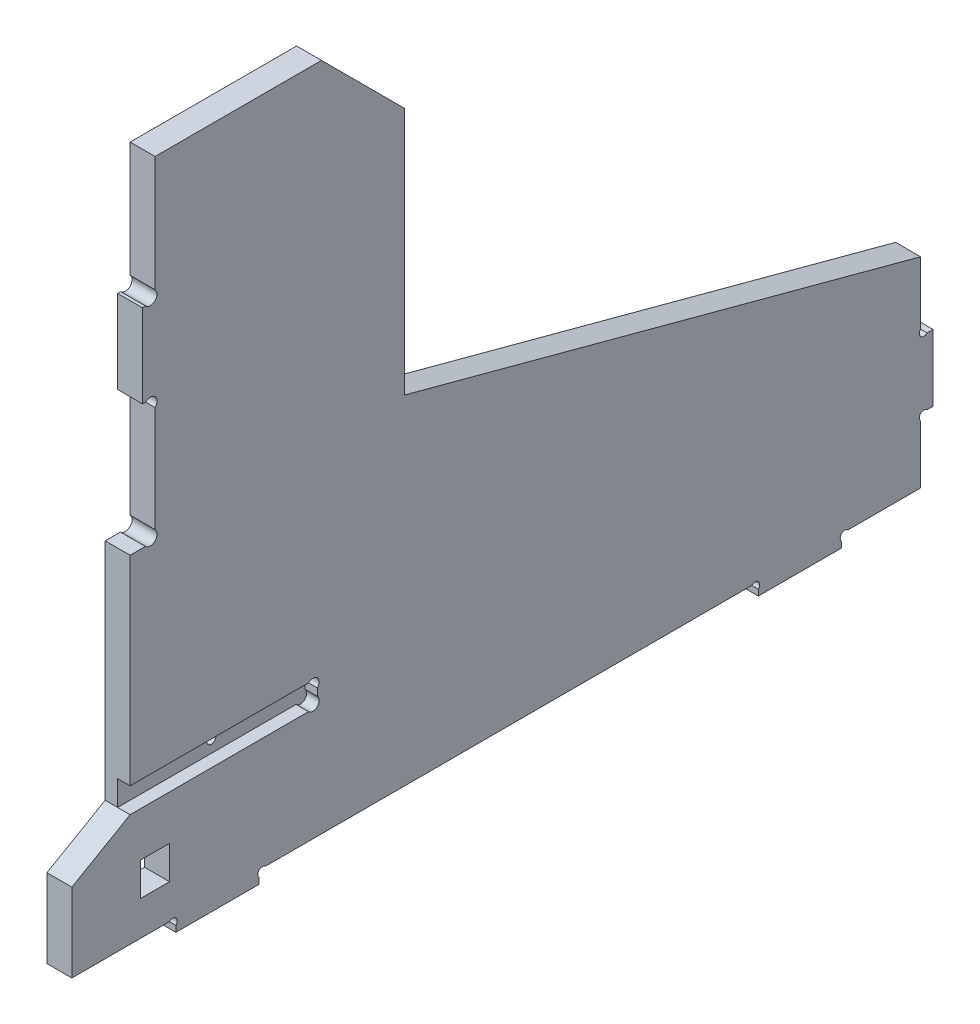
SolidWorks part; units mm, degrees
ref_plane "Plan de face" through (0, 0, 0) normal (0, 0, 1) x (1, 0, 0)
ref_plane "Plan de dessus" through (0, 0, 0) normal (0, 1, 0) x (1, 0, 0)
ref_plane "Plan de droite" through (0, 0, 0) normal (1, 0, 0) x (0, 0, -1)
sketch "Esquisse1" plane through (0, 0, 0) normal (1, 0, 0) x (0, 0, -1)
  line L0 (0, -10.3129) -> (0, 191.2158) construction
  line L1 (-27.1936, 0) -> (214.3341, 0) construction
  line L2 (207, -15.5234) -> (207, 186.2154) construction
  line L3 (105, -15.5234) -> (105, 6.2979) construction
  line L4 (17, 137.2152) -> (17, 104.3661) construction
  line L5 (20, 164) -> (20, 136.2627)
  line L6 (0, 21.9171) -> (0, 3)
  line L7 (-27.1936, 30) -> (200.5597, 30) construction
  line L8 (-10.2862, 124) -> (23.4444, 124) construction
  line L9 (5.4347, 134) -> (24.048, 134) construction
  line L10 (60, 164) -> (80, 144) construction
  line L11 (214.3341, 164) -> (-7.6552, 164) construction
  line L12 (60, 164) -> (80, 144)
  line L13 (185, 3) -> (195.7444, -7.7444) construction
  line L14 (185, 1.4444) -> (185, 0)
  line L15 (80, 144) -> (80, 84.3557)
  line L16 (20, 134) -> (8.5345, 145.4655) construction
  line L17 (185, 0) -> (165, 0)
  line L18 (20, 164) -> (60, 164)
  line L19 (165, 0) -> (165, 1.4444)
  line L20 (186.5556, 3) -> (204, 3)
  line L21 (204, 3) -> (-12.7537, 3) construction
  line L22 (45, 0) -> (45, 1.4444)
  line L23 (25, 0) -> (45, 0)
  line L24 (25, 1.4444) -> (25, 0)
  line L25 (46.5556, 3) -> (163.4444, 3)
  line L26 (187, 26.5) -> (198.6582, 26.5) construction
  line L27 (198.6582, 18.5) -> (181.0711, 18.5) construction
  line L28 (204, 18.5) -> (215.3091, 7.1909) construction
  line L29 (205.5556, 34.5) -> (207, 34.5)
  line L30 (205.5556, 18.5) -> (207, 18.5)
  line L31 (204, 16.9444) -> (204, 3)
  line L32 (204, 36.0556) -> (204, 51.13)
  line L33 (207, 34.5) -> (207, 18.5)
  line L34 (-12.7537, 11.3) -> (40.6336, 11.3) construction
  line L35 (20, 65.49) -> (20, 173.6999) construction
  line L36 (-10.2862, 84) -> (23.4444, 84) construction
  line L37 (17.7373, 134) -> (17, 134)
  line L38 (80, 77.5865) -> (80, 173.6999) construction
  line L39 (14, 85.8493) -> (14, 36.0556) construction
  line L40 (20, 84) -> (6.6038, 97.3962) construction
  line L41 (14, 30) -> (14, 84)
  line L42 (14, 30) -> (0, 21.9171)
  line L43 (204, 3) -> (204, 70.5) construction
  line L44 (204, 51.13) -> (80, 84.3557)
  line L45 (17, 134) -> (17, 114)
  line L46 (17, 114) -> (17.7373, 114)
  line L47 (20, 111.7373) -> (20, 86.3335)
  line L48 (14, 84) -> (17.6665, 84)
  line L49 (9.8882, 33) -> (53.631, 33) construction
  line L50 (19.98, 19.513) -> (19.98, 59.3166) construction
  line L51 (40.6336, 19.3) -> (-12.7537, 19.3) construction
  line L52 (16.48, 39.3623) -> (16.48, 66.3531) construction
  line L53 (23.48, 39.3623) -> (23.48, 66.3531) construction
  line L54 (0, 3) -> (23.4444, 3)
  line L55 (185, -15.5234) -> (185, 7.1909) construction
  line L56 (36.5, 46.6302) -> (36.5, 25.1596) construction
  line L57 (175, 6.2979) -> (175, -4.4633) construction
  line L58 (16.48, 19.3) -> (23.48, 19.3)
  line L59 (16.48, 19.3) -> (16.48, 11.3)
  line L60 (16.48, 11.3) -> (23.48, 11.3)
  line L61 (23.48, 19.3) -> (23.48, 11.3)
  arc A0 (17.7373, 134) -> (20, 136.2627) centre (18.8686, 135.1314) ccw
  arc A1 (17.7373, 114) -> (20, 111.7373) centre (18.8686, 112.8686) cw
  arc A2 (186.5556, 3) -> (185, 1.4444) centre (185.7778, 2.2222) ccw
  arc A3 (163.4444, 3) -> (165, 1.4444) centre (164.2222, 2.2222) cw
  arc A4 (46.5556, 3) -> (45, 1.4444) centre (45.7778, 2.2222) ccw
  arc A5 (23.4444, 3) -> (25, 1.4444) centre (24.2222, 2.2222) cw
  arc A6 (205.5556, 18.5) -> (204, 16.9444) centre (204.7778, 17.7222) ccw
  arc A7 (205.5556, 34.5) -> (204, 36.0556) centre (204.7778, 35.2778) cw
  arc A9 (17.6665, 84) -> (20, 86.3335) centre (18.8333, 85.1667) ccw
  circle A10 centre (36.5, 33) radius 1.1
  dimension "D15" = 3
  dimension "D23" = 3
  dimension "D12" = 10
  dimension "D13" = 8
  dimension "D16" = 60
  dimension "D11" = 6
  dimension "D18" = 45
  dimension "D20" = 40
  dimension "D21" = 5.98
  dimension "D24" = 8
  dimension "D3" = 22
  dimension "D27" = 120
  dimension "D2" = 207
  dimension "D4" = 45
  dimension "D5" = 3
  dimension "D6" = 30
  dimension "D7" = 40
  dimension "D8" = 48.13
  dimension "D9" = 45
  dimension "D10" = 134
  dimension "D14" = 45
  dimension "D17" = 45
  dimension "D19" = 10
  dimension "D22" = 3
  dimension "D25" = 80
  dimension "D26" = 7
  dimension "D28" = 105
  dimension "D29" = 8.3
  dimension "D30" = 3.5
  dimension "D31" = 22.5
extrude "Boss.-Extru.1" add sketch "Esquisse1" along normal blind 6
sketch "Esquisse2" plane through (6, 0, 0) normal (1, 0, 0) x (0, 0, -1)
  line L0 (-21.321, 3) -> (210.4558, 3) construction
  line L1 (-21.321, 30) -> (94.5674, 30) construction
  line L2 (14, 103.5087) -> (14, -14.2603) construction
  line L3 (59, 103.5087) -> (59, -14.2603) construction
  line L4 (-21.321, 36) -> (75.4362, 36) construction
  line L5 (5.4648, 33) -> (75.4362, 33) construction
  line L6 (59, 30) -> (40.5881, 48.4119) construction
  line L7 (59, 33.8787) -> (59, 32.1213)
  line L8 (14, 36) -> (14, 30)
  line L9 (14, 30) -> (56.8787, 30)
  line L10 (14, 36) -> (56.8787, 36)
  arc A0 (56.8787, 30) -> (59, 32.1213) centre (57.9393, 31.0607) ccw
  arc A1 (56.8787, 36) -> (59, 33.8787) centre (57.9393, 34.9393) cw
  dimension "D1" = 27
  dimension "D2" = 3
  dimension "D3" = 6
  dimension "D4" = 45
  dimension "D5" = 45
extrude "Enlèv. mat.-Extru.1" cut sketch "Esquisse2" against normal blind 3
